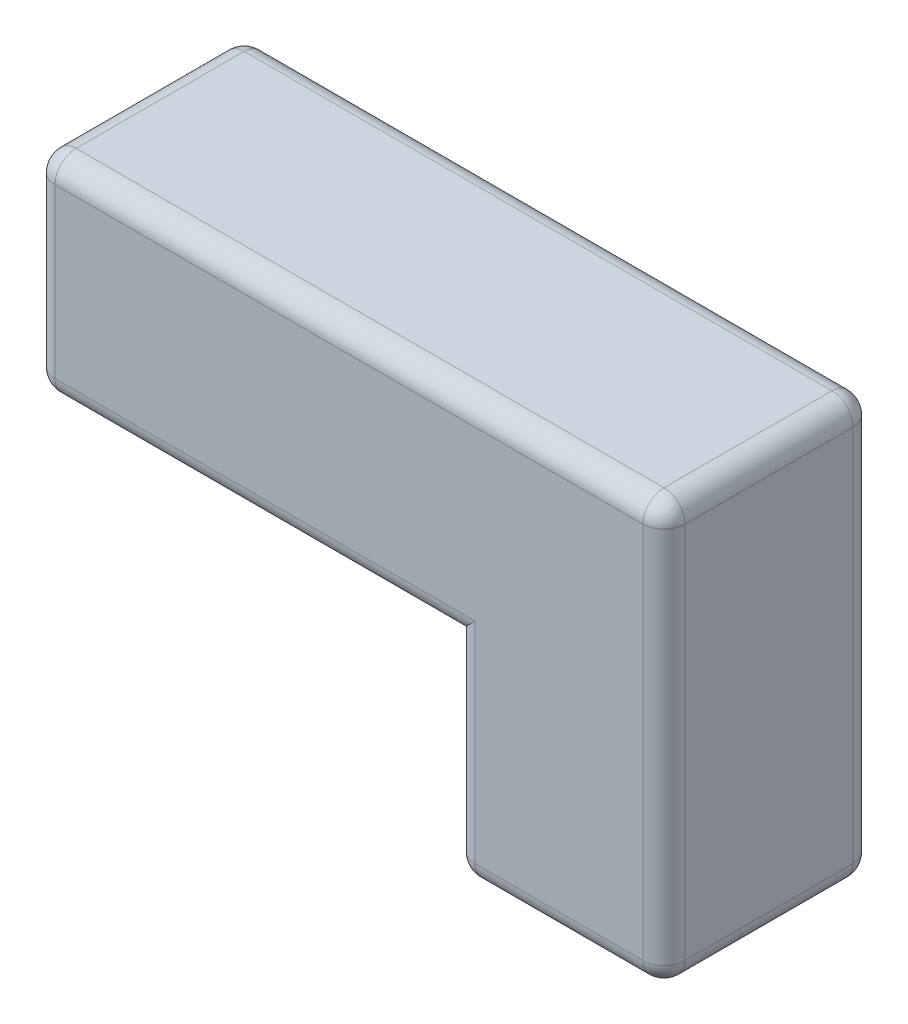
SolidWorks part; units mm, degrees
ref_plane "Front Plane" through (0, 0, 0) normal (0, 0, 1) x (1, 0, 0)
ref_plane "Top Plane" through (0, 0, 0) normal (0, 1, 0) x (1, 0, 0)
ref_plane "Right Plane" through (0, 0, 0) normal (1, 0, 0) x (0, 0, -1)
sketch "Sketch1" plane through (0, 0, 0) normal (0, 0, 1) x (1, 0, 0)
  line L1 (-326.4, 114.7403) -> (-26.4, 114.7403)
  line L2 (-326.4, 114.7403) -> (-326.4, 14.7403)
  line L3 (-326.4, 14.7403) -> (-126.4, 14.7403)
  line L4 (-26.4, 114.7403) -> (-26.4, 14.7403)
  line L6 (-26.4, 14.7403) -> (-26.4, -85.2597)
  line L7 (-26.4, -85.2597) -> (-126.4, -85.2597)
  line L8 (-126.4, 14.7403) -> (-126.4, -85.2597)
  dimension "D1" = 100
  dimension "D2" = 300
  dimension "D3" = 100
  dimension "D4" = 100
extrude "Boss-Extrude1" add sketch "Sketch1" along normal blind 100
fillet "Fillet2" radius 10 17 edges at (-126.4, -85.2597, 50) (-326.4, 14.7403, 50) (-226.4, 14.7403, 0) (-126.4, -35.2597, 0) (-76.4, -85.2597, 0) (-326.4, 64.7403, 0) (-26.4, -85.2597, 50) (-26.4, 14.7403, 0) (-26.4, 114.7403, 50) (-326.4, 114.7403, 50) (-176.4, 114.7403, 0) (-176.4, 114.7403, 100) (-26.4, 14.7403, 100) (-76.4, -85.2597, 100) (-126.4, -35.2597, 100) (-226.4, 14.7403, 100) (-326.4, 64.7403, 100)
